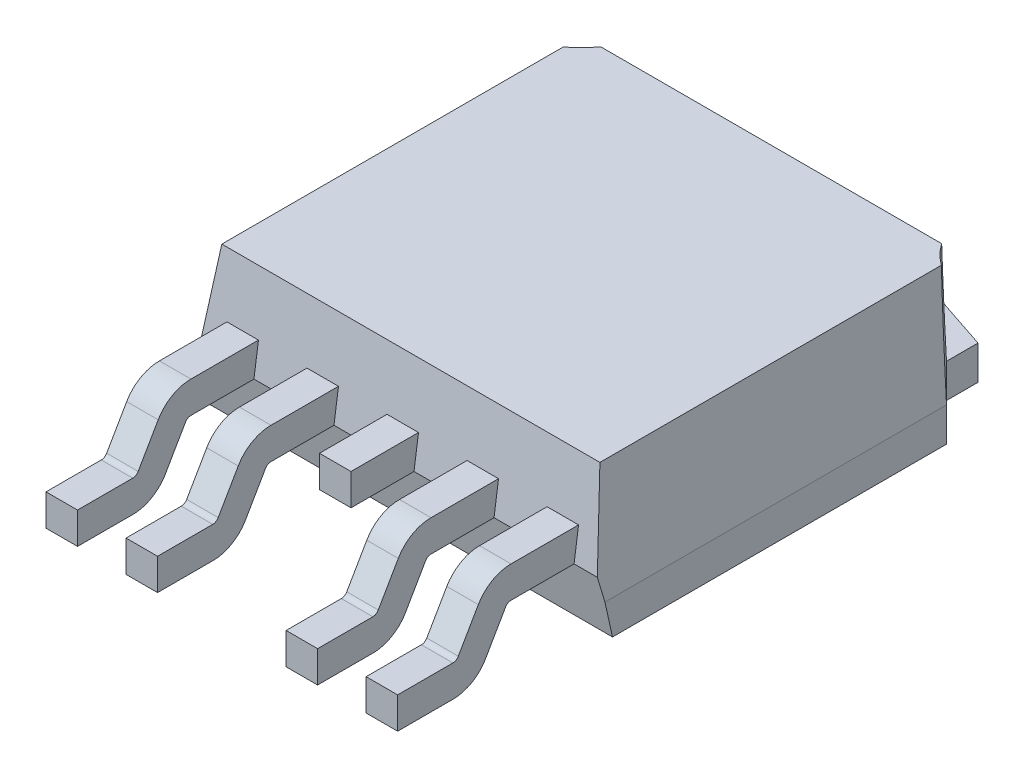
SolidWorks part; units mm, degrees
ref_plane "Front Plane" through (0, 0, 0) normal (0, 0, 1) x (1, 0, 0)
ref_plane "Top Plane" through (0, 0, 0) normal (0, 1, 0) x (1, 0, 0)
ref_plane "Right Plane" through (0, 0, 0) normal (1, 0, 0) x (0, 0, -1)
sketch "Sketch1" plane through (0, 0, 0) normal (0, 1, 0) x (1, 0, 0)
  line L0 (0.65, 5.1) -> (-0.25, 4.8)
  line L1 (0, 0) -> (4.7, 0)
  line L2 (0, 3.8) -> (0, 0)
  line L3 (0.65, 5.1) -> (4.05, 5.1) construction
  line L4 (4.7, 3.8) -> (4.7, 0)
  line L5 (-0.25, 4.8) -> (-0.25, 3.8)
  line L6 (-0.25, 3.8) -> (0, 3.8)
  line L7 (4.05, 5.1) -> (4.95, 4.8)
  line L8 (4.95, 4.8) -> (4.95, 3.8)
  line L9 (4.95, 3.8) -> (4.7, 3.8)
  line L10 (1.55, 5.1) -> (1.55, 4.7)
  line L11 (1.55, 4.7) -> (3.15, 4.7)
  line L12 (3.15, 4.7) -> (3.15, 5.1)
  line L13 (0.65, 5.1) -> (1.55, 5.1)
  line L14 (3.15, 5.1) -> (4.05, 5.1)
  line L15 (2.35, 4.0747) -> (2.35, 1.2652) construction
  line L16 (1.55, 3.6) -> (3.15, 3.6) construction
  line L17 (1.55, 3.9) -> (3.15, 3.9)
  line L18 (3.15, 3.9) -> (3.15, 3.3) construction
  line L19 (3.15, 3.3) -> (1.55, 3.3)
  line L20 (1.55, 3.3) -> (1.55, 3.9) construction
  arc A0 (1.55, 3.9) -> (1.55, 3.3) centre (1.55, 3.6) ccw
  arc A1 (3.15, 3.9) -> (3.15, 3.3) centre (3.15, 3.6) cw
  dimension "D1" = 0.25
  dimension "D2" = 0.25
  dimension "D3" = 4.7
  dimension "D4" = 5.1
  dimension "D5" = 0.3
  dimension "D6" = 0.9
  dimension "D7" = 0.3
  dimension "D8" = 0.9
  dimension "D9" = 3.8
  dimension "D10" = 3.8
  dimension "D11" = 0.9
  dimension "D12" = 0.9
  dimension "D13" = 0.4
  dimension "D14" = 2.35
  dimension "D15" = 0.2
  dimension "D16" = 0.3
extrude "Boss-Extrude1" add sketch "Sketch1" along normal blind 0.54
sketch "Sketch2" plane through (0, 0, 0) normal (0, 1, 0) x (1, 0, 0)
  line L0 (-0.25, 4.3) -> (4.95, 4.3)
  line L1 (-0.25, 4.8) -> (-0.25, 3.8) construction
  line L2 (4.95, 3.8) -> (4.95, 4.8) construction
  line L3 (5.55, 3.7) -> (5.55, -1.8)
  line L4 (3.45, 3.6) -> (5.4039, 3.6) construction
  line L5 (5.55, 3.7) -> (4.95, 3.7) construction
  line L6 (4.95, 3.7) -> (5.55, 4.3) construction
  line L7 (5.55, 4.3) -> (6.6284, 5.3784) construction
  line L8 (5.55, -1.8) -> (-0.85, -1.8)
  line L9 (-0.85, -1.8) -> (-0.85, 3.7)
  line L10 (4.95, 3.7) -> (-0.85, 3.7) construction
  line L11 (-0.25, 3.7) -> (-0.25, 2.976) construction
  line L12 (-0.25, 3.7) -> (-0.85, 4.3) construction
  line L13 (-0.85, 4.3) -> (-2.1215, 5.5715) construction
  line L14 (6.0892, 4.8392) -> (-1.3892, 4.8392) construction
  arc A0 (3.15, 3.3) -> (3.15, 3.9) centre (3.15, 3.6) ccw construction
  arc A1 (4.95, 4.3) -> (5.55, 3.7) centre (6.0892, 4.8392) ccw
  arc A2 (-0.25, 4.3) -> (-0.85, 3.7) centre (-1.3892, 4.8392) cw
  dimension "D1" = 0.6
  dimension "D2" = 0.6
  dimension "D3" = 6.1
  dimension "D4" = 6.4
extrude "Boss-Extrude3" add sketch "Sketch2" along normal blind 2.3 separate body
sketch "Sketch3" plane through (0, 0, 0) normal (0, 1, 0) x (1, 0, 0)
  line L14 (0, 3.8) -> (0, 0)
  line L15 (-0.25, 3.8) -> (0, 3.8)
  line L16 (-0.25, 4.8) -> (-0.25, 3.8)
  line L17 (0.65, 5.1) -> (-0.25, 4.8)
  line L18 (1.55, 5.1) -> (0.65, 5.1)
  line L19 (1.55, 4.7) -> (1.55, 5.1)
  line L20 (3.15, 4.7) -> (1.55, 4.7)
  line L21 (3.15, 5.1) -> (3.15, 4.7)
  line L22 (4.05, 5.1) -> (3.15, 5.1)
  line L23 (4.95, 4.8) -> (4.05, 5.1)
  line L24 (4.95, 3.8) -> (4.95, 4.8)
  line L25 (4.7, 3.8) -> (4.95, 3.8)
  line L26 (4.7, 0) -> (4.7, 3.8)
  line L27 (0, 0) -> (4.7, 0)
  line L28 (0, 3.8) -> (0, 0)
  line L29 (-0.25, 3.8) -> (0, 3.8)
  line L30 (4.95, 3.8) -> (4.95, 4.3)
  line L31 (4.95, 4.3) -> (-0.25, 4.3)
  line L32 (-0.25, 4.8) -> (-0.25, 3.8) construction
  line L33 (-0.25, 4.3) -> (-0.25, 3.8)
  line L39 (4.7, 3.8) -> (4.95, 3.8)
  line L40 (4.7, 0) -> (4.7, 3.8)
  line L41 (0, 0) -> (4.7, 0)
  line L70 (3.15, 3.9) -> (1.55, 3.9) construction
  line L71 (1.55, 3.3) -> (3.15, 3.3) construction
  line L72 (3.15, 3.9) -> (1.55, 3.9)
  line L73 (1.55, 3.3) -> (3.15, 3.3)
  arc A0 (3.15, 3.3) -> (3.15, 3.9) centre (3.15, 3.6) ccw construction
  arc A1 (1.55, 3.9) -> (1.55, 3.3) centre (1.55, 3.6) ccw construction
  arc A2 (3.15, 3.3) -> (3.15, 3.9) centre (3.15, 3.6) ccw
  arc A3 (1.55, 3.9) -> (1.55, 3.3) centre (1.55, 3.6) ccw
  dimension "D1" = 0
extrude "Cut-Extrude1" cut sketch "Sketch3" along normal blind 0.05
sketch "Sketch6" plane through (5.55, 0, 0) normal (1, 0, 0) x (0, 0, -1)
  line L0 (4.1, 2.4731) -> (4.3, 0.54)
  line L1 (4.3, 0.54) -> (4.3, 2.4731)
  line L2 (4.3, 2.4731) -> (4.1, 2.4731)
  line L3 (3.8, 0.54) -> (4.8, 0.54) construction
  line L4 (4.3, 2.3) -> (4.3, 0.05) construction
  line L5 (-1.8, 0.9) -> (-1.8, 2.3)
  line L6 (-1.8, 2.3) -> (-1.8, 0) construction
  line L7 (-1.8, 2.3) -> (3.7, 2.3) construction
  line L8 (-1.8, 2.3) -> (-1.6, 2.3)
  line L9 (-1.6, 2.3) -> (-1.8, 0.9)
  dimension "D1" = 0
  dimension "D2" = 0
  dimension "D3" = 0.2
  dimension "D4" = 0.2
  dimension "D5" = 1.4
extrude "Cut-Extrude2" cut sketch "Sketch6" against normal blind 7
sketch "Sketch7" plane through (0, 0, -4.3) normal (0, 0, -1) x (-1, 0, 0)
  line L0 (-5.35, 2.3) -> (-5.55, 2.3)
  line L1 (0.65, 2.3) -> (0.85, 2.3)
  line L2 (0.85, 2.3) -> (0.85, 0.54)
  line L3 (-5.55, 2.3) -> (-5.55, 0) construction
  line L6 (-5.0556, 2.3) -> (0.3556, 2.3) construction
  line L7 (-5.35, 2.3) -> (-5.55, 0.54)
  line L8 (-5.55, 0.54) -> (-5.55, 2.3)
  line L9 (0.85, 0.54) -> (0.65, 2.3)
  line L10 (0.85, 2.3) -> (0.85, 0) construction
  dimension "D1" = 0
  dimension "D2" = 0
  dimension "D3" = 0.2
  dimension "D4" = 0
extrude "Cut-Extrude3" cut sketch "Sketch7" against normal blind 7
sketch "Sketch9" plane through (5.55, 0, 0) normal (1, 0, 0) x (0, 0, -1)
  line L0 (-1.8, 0) -> (-1.8, 0.9)
  line L1 (-1.8, 0.9) -> (-1.6, 0)
  line L2 (-1.8, 0) -> (3.7, 0) construction
  line L3 (-1.6, 0) -> (-1.8, 0)
  dimension "D1" = 0.2
extrude "Cut-Extrude4" cut sketch "Sketch9" against normal blind 7
ref_plane "Plane1" through (-0.44, 0, 0) normal (1, 0, 0) x (0, 0, -1)
sketch "Sketch10" plane through (-0.44, 0, 0) normal (1, 0, 0) x (0, 0, -1)
  line L0 (-1.8, 0.9) -> (-2.8, 0.9)
  line L1 (-2.8, 0.9) -> (-2.8, 1.4) construction
  line L2 (-2.8, 1.4) -> (-1.5889, 1.4)
  line L3 (-4.6, 1.3392) -> (-4.6, 0) construction
  line L4 (-4.6, 0) -> (-3.7, 0)
  line L5 (-4.6, 0.5) -> (-3.7, 0.5) construction
  line L6 (-4.6, 0.5) -> (-4.6, 0)
  line L7 (-2.8866, 0.85) -> (-3.4581, -0.1398) construction
  line L8 (-3.3196, 1.1) -> (-3.86, 0.164) construction
  line L9 (-3.7, 0.5) -> (-3.3825, 0.5) construction
  line L10 (-3.7, 0) -> (-3.023, 0) construction
  line L11 (-3.3774, 0) -> (-3.666, 0.5) construction
  line L12 (-3.666, 0.5) -> (-4.0791, 1.2155) construction
  line L13 (-4.0576, 0.6) -> (-3.4767, 0.6) construction
  line L14 (-3.7238, 0.5) -> (-4.6, 0.5)
  line L15 (-3.6372, 0.55) -> (-3.3196, 1.1)
  line L16 (-2.8866, 0.85) -> (-3.216, 0.2794)
  line L18 (-1.5889, 1.4) -> (-1.5889, 0.9)
  line L19 (-1.5889, 0.9) -> (-1.8, 0.9)
  arc A0 (-2.8, 0.9) -> (-2.8866, 0.85) centre (-2.8, 0.8) ccw
  arc A1 (-2.8, 1.4) -> (-3.3196, 1.1) centre (-2.8, 0.8) ccw
  arc A2 (-3.7238, 0.5) -> (-3.6372, 0.55) centre (-3.7238, 0.6) ccw
  arc A3 (-3.7, 0) -> (-3.216, 0.2794) centre (-3.7238, 0.6) ccw
  dimension "D7" = 0.1
  dimension "D1" = 0.5
  dimension "D2" = 2.8
  dimension "D3" = 1
  dimension "D4" = 0.9
  dimension "D5" = 0.5
extrude "Boss-Extrude4" add sketch "Sketch10" along normal blind 0.5
pattern_linear "LPattern1" count 2 spacing 1.27 along (1, 0, 0) of "Boss-Extrude4"
pattern_linear "LPattern2" count 2 spacing 3.81 along (1, 0, 0) of "Boss-Extrude4"
pattern_linear "LPattern3" count 2 spacing 5.08 along (1, 0, 0) of "Boss-Extrude4"
ref_plane "Plane2" through (2.1, 0, 0) normal (1, 0, 0) x (0, 0, -1)
sketch "Sketch11" plane through (2.1, 0, 0) normal (1, 0, 0) x (0, 0, -1)
  line L0 (-2.8, 0.9) -> (-2.8, 1.4)
  line L8 (-1.7286, 1.4) -> (-2.8, 1.4)
  line L9 (-1.8, 0.9) -> (-1.7286, 1.4)
  line L10 (-2.8, 0.9) -> (-1.8, 0.9)
  line L11 (-3.216, 0.2794) -> (-2.8866, 0.85)
  line L12 (-4.6, 0) -> (-3.7, 0)
  line L13 (-4.6, 0.5) -> (-4.6, 0)
  line L14 (-3.7238, 0.5) -> (-4.6, 0.5)
  line L15 (-3.3196, 1.1) -> (-3.6372, 0.55)
  line L16 (-1.7286, 1.4) -> (-2.8, 1.4)
  line L17 (-1.8, 0.9) -> (-1.7286, 1.4)
  line L18 (-2.8, 0.9) -> (-1.8, 0.9)
  arc A4 (-2.8, 0.9) -> (-2.8866, 0.85) centre (-2.8, 0.8) ccw
  arc A5 (-3.7, 0) -> (-3.216, 0.2794) centre (-3.7238, 0.6) ccw
  arc A6 (-3.7238, 0.5) -> (-3.6372, 0.55) centre (-3.7238, 0.6) ccw
  arc A7 (-2.8, 1.4) -> (-3.3196, 1.1) centre (-2.8, 0.8) ccw
  dimension "D1" = 0
extrude "Boss-Extrude5" add sketch "Sketch11" along normal blind 0.5
